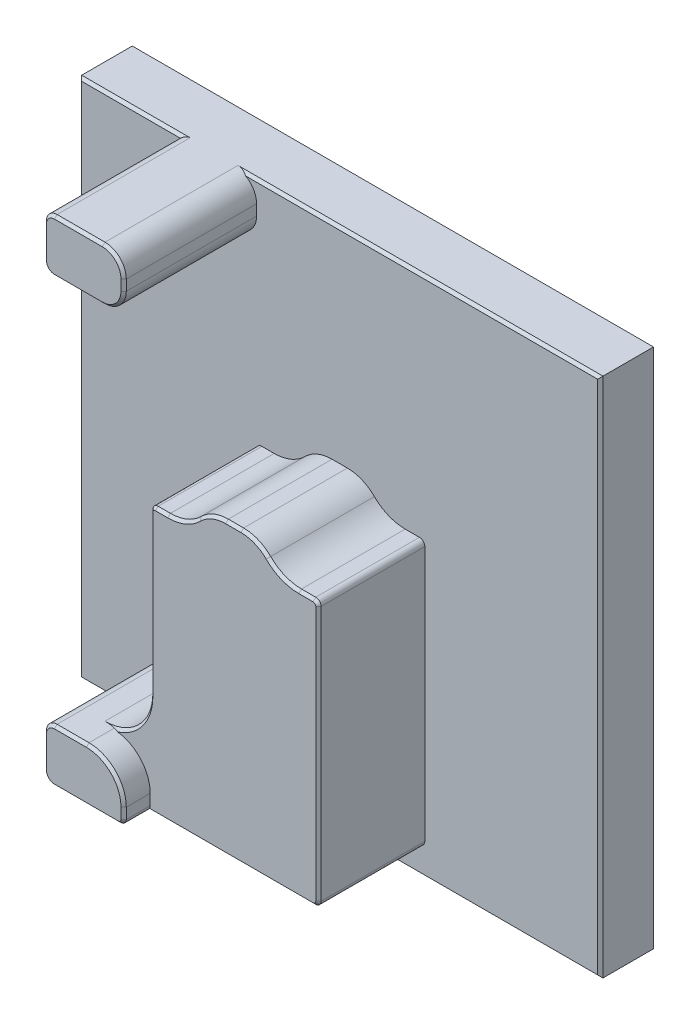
SolidWorks part; units mm, degrees
ref_plane "Plan de face" through (0, 0, 0) normal (0, 0, 1) x (1, 0, 0)
ref_plane "Plan de dessus" through (0, 0, 0) normal (0, 1, 0) x (1, 0, 0)
ref_plane "Plan de droite" through (0, 0, 0) normal (1, 0, 0) x (0, 0, -1)
sketch "Esquisse1" plane through (0, 0, 0) normal (0, 0, 1) x (1, 0, 0)
  line L1 (0, 0) -> (98, 0)
  line L2 (0, 0) -> (0, 98)
  line L3 (0, 98) -> (98, 98)
  line L4 (98, 0) -> (98, 98)
  dimension "D1" = 98
  dimension "D2" = 98
extrude "Boss.-Extru.1" add sketch "Esquisse1" along normal blind 35
sketch "Esquisse2" plane through (0, 0, 35) normal (0, 0, 1) x (1, 0, 0)
  line L0 (49, 98) -> (49, 0) construction
  line L1 (98, 98) -> (0, 98) construction
  line L2 (0, 0) -> (98, 0) construction
  line L3 (33.375, 98) -> (33.375, 55)
  line L4 (33.375, 55) -> (44, 55)
  line L5 (44, 55) -> (44, 59.5)
  line L6 (44, 59.5) -> (54, 59.5)
  line L7 (54, 59.5) -> (54, 55)
  line L8 (54, 55) -> (65, 55)
  line L9 (65, 55) -> (65, 5)
  line L10 (65, 5) -> (33.375, 5)
  line L11 (33.375, 5) -> (33.375, 0)
  line L12 (33.375, 0) -> (98, 0)
  line L13 (98, 0) -> (98, 98)
  line L14 (98, 98) -> (33.375, 98)
  dimension "D1" = 15.625
  dimension "D2" = 10
  dimension "D3" = 5
  dimension "D4" = 16
  dimension "D5" = 4.5
  dimension "D6" = 50
  dimension "D7" = 5
extrude "Enlèv. mat.-Extru.1" cut sketch "Esquisse2" against normal blind 25
sketch "Esquisse3" plane through (0, 0, 35) normal (0, 0, 1) x (1, 0, 0)
  line L0 (33.375, 5) -> (33.375, 55)
  line L12 (0, 0) -> (33.375, 0)
  line L13 (33.375, 0) -> (33.375, 5)
  line L14 (33.375, 5) -> (65, 5)
  line L15 (65, 5) -> (65, 55)
  line L16 (65, 55) -> (54, 55)
  line L17 (54, 55) -> (54, 59.5)
  line L18 (54, 59.5) -> (44, 59.5)
  line L19 (44, 59.5) -> (44, 55)
  line L20 (44, 55) -> (33.375, 55)
  line L21 (33.375, 55) -> (33.375, 98)
  line L22 (33.375, 98) -> (0, 98)
  line L23 (0, 98) -> (0, 0)
  line L26 (33.375, 5) -> (65, 5)
  line L27 (65, 5) -> (65, 55)
  line L28 (65, 55) -> (54, 55)
  line L29 (54, 55) -> (54, 59.5)
  line L30 (54, 59.5) -> (44, 59.5)
  line L31 (44, 59.5) -> (44, 55)
  line L32 (44, 55) -> (33.375, 55)
  dimension "D1" = 0
extrude "Enlèv. mat.-Extru.2" cut sketch "Esquisse3" against normal blind 5
fillet "Congé1" radius 8.2 2 edges at (54, 55, 20) (44, 55, 20)
fillet "Congé2" radius 1 2 edges at (65, 5, 20) (65, 55, 20)
fillet "Congé3" radius 7.2 2 edges at (54, 59.5, 20) (44, 59.5, 20)
sketch "Esquisse4" plane through (0, 0, 35) normal (0, 0, 1) x (1, 0, 0)
  line L1 (33.375, 5) -> (0, 5)
  line L2 (33.375, 5) -> (33.375, 0)
  line L3 (33.375, 0) -> (0, 0)
  line L4 (0, 5) -> (0, 0)
extrude "Enlèv. mat.-Extru.3" cut sketch "Esquisse4" against normal up to surface (25 mm away)
sketch "Esquisse5" plane through (0, 0, 35) normal (0, 0, 1) x (1, 0, 0)
  line L0 (18.375, 5) -> (18.375, 15)
  line L1 (33.375, 5) -> (0, 5) construction
  line L2 (18.375, 15) -> (33.375, 15)
  line L3 (33.375, 98) -> (33.375, 5) construction
  line L4 (33.375, 15) -> (33.375, 88)
  line L5 (33.375, 88) -> (18.375, 88)
  line L6 (18.375, 88) -> (18.375, 98)
  line L7 (33.375, 98) -> (0, 98) construction
  line L8 (18.375, 98) -> (0, 98)
  line L9 (0, 98) -> (0, 5)
  line L10 (0, 5) -> (18.375, 5)
  dimension "D1" = 10
  dimension "D2" = 15
extrude "Enlèv. mat.-Extru.4" cut sketch "Esquisse5" against normal up to surface (25 mm away)
fillet "Congé4" radius 4 2 edges at (33.375, 98, 22.5) (33.375, 88, 22.5)
fillet "Congé5" radius 2 4 edges at (18.375, 5, 22.5) (18.375, 15, 22.5) (18.375, 98, 22.5) (18.375, 88, 22.5)
fillet "Congé6" radius 1 1 edges at (33.375, 55, 20)
fillet "Congé7" radius 1 1 edges at (33.375, 5, 32.5)
fillet "Congé10" radius 9 1 edges at (33.375, 15, 20)
fillet "Congé8" radius 7 1 edges at (33.375, 15, 32.5)
chamfer "Chanfrein1" distance 0.5 angle 45 34 edges at (33.0821, 5.2929, 35) (26.375, 5, 35) (18.9608, 5.5858, 35) (18.375, 10, 35) (18.9608, 14.4142, 35) (23.375, 15, 35) (31.3247, 12.9497, 35) (33.375, 93, 35) (32.2034, 96.8284, 35) (32.2034, 89.1716, 35) (24.875, 88, 35) (18.9608, 88.5858, 35) (18.375, 93, 35) (18.9608, 97.4142, 35) (24.875, 98, 35) (48.1875, 5, 30) (64.7071, 5.2929, 30) (65, 30, 30) (64.7071, 54.7071, 30) (62.6589, 55, 30) (58.1835, 55.6227, 30) (53.191, 58.9533, 30) (49, 59.5, 30) (44.809, 58.9533, 30) (39.8165, 55.6227, 30) (35.5286, 55, 30) (33.6679, 54.7071, 30) (33.375, 39, 30) (30.739, 17.636, 30) (10.1875, 98, 10) (63.6875, 98, 10) (98, 49, 10) (49, 0, 10) (0, 49, 10)
